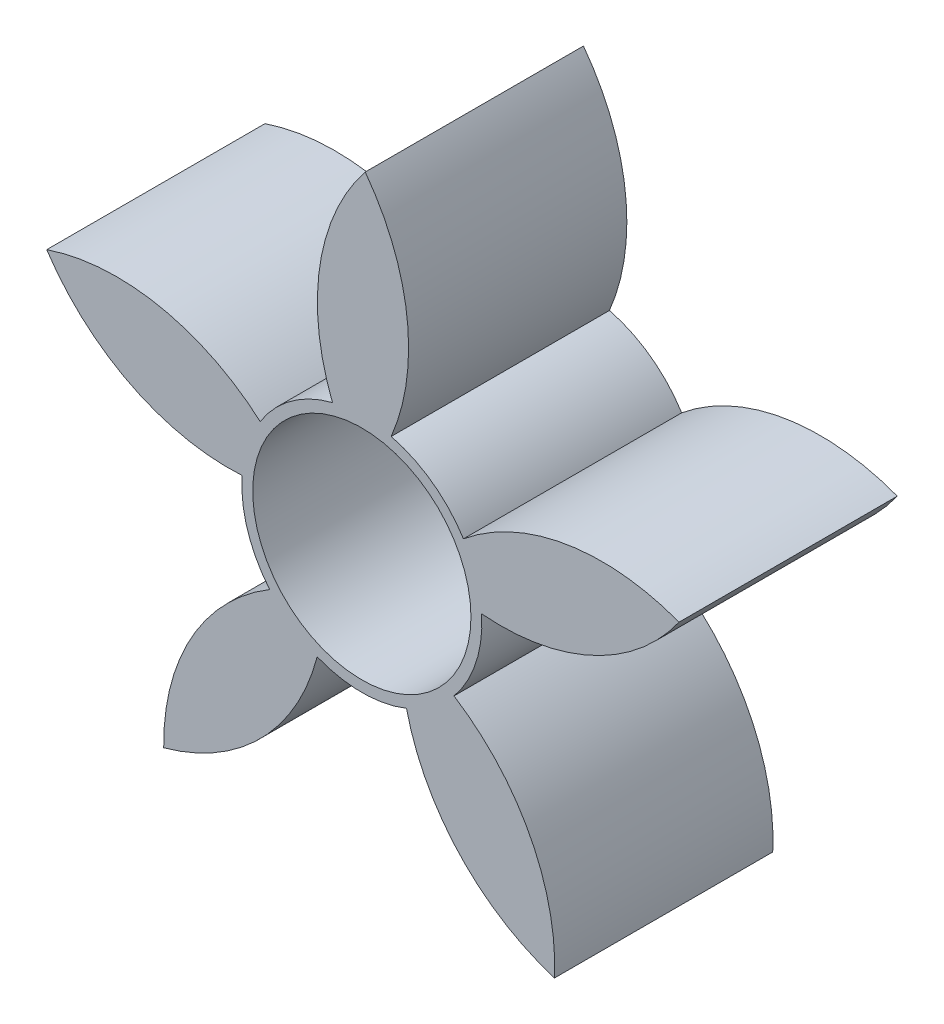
SolidWorks part; units mm, degrees
ref_plane "Front Plane" through (0, 0, 0) normal (0, 0, 1) x (1, 0, 0)
ref_plane "Top Plane" through (0, 0, 0) normal (0, 1, 0) x (1, 0, 0)
ref_plane "Right Plane" through (0, 0, 0) normal (1, 0, 0) x (0, 0, -1)
sketch "Sketch1" plane through (0, 0, 0) normal (0, 0, 1) x (1, 0, 0)
  line L0 (37.1628, 13.5459) -> (-20.3686, 13.5459) construction
  circle A0 centre (0, 0) radius 12.7
  arc A1 (11.8272, 7.435) -> (3.4163, 13.5459) centre (0, 0) ccw
  arc A2 (3.4163, 13.5459) -> (0.3935, 38.691) centre (-19.956, 23.4905) ccw
  arc A3 (0.3935, 38.691) -> (-3.4163, 13.5459) centre (20.2283, 22.8247) ccw
  arc A4 (36.919, 11.582) -> (11.8272, 7.435) centre (27.9584, -12.185) ccw
  arc A5 (13.9386, 0.9368) -> (36.919, 11.582) centre (16.174, 26.2383) ccw
  arc A6 (22.4237, -31.533) -> (10.7259, -8.9508) centre (-2.949, -30.3554) ccw
  arc A7 (5.1982, -12.9668) -> (22.4237, -31.533) centre (29.9521, -7.2743) ccw
  arc A8 (-23.0604, -31.0704) -> (-5.1982, -12.9668) centre (-29.781, -6.5757) ccw
  arc A9 (-10.7259, -8.9508) -> (-23.0604, -31.0704) centre (2.3374, -30.7341) ccw
  arc A10 (-36.6758, 12.3304) -> (-13.9386, 0.9368) centre (-15.4567, 26.2914) ccw
  arc A11 (-11.8272, 7.435) -> (-36.6758, 12.3304) centre (-28.5075, -11.7204) ccw
  arc A12 (-13.9386, 0.9368) -> (-10.7259, -8.9508) centre (0, 0) ccw
  arc A13 (-5.1982, -12.9668) -> (5.1982, -12.9668) centre (0, 0) ccw
  arc A14 (10.7259, -8.9508) -> (13.9386, 0.9368) centre (0, 0) ccw
  arc A15 (-3.4163, 13.5459) -> (-11.8272, 7.435) centre (0, 0) ccw
  point P34 (0, 0)
  dimension "D1" = 25.4
  dimension "D2" = 27.94
  dimension "D3" = 25.4
  dimension "D4" = 25.4
  dimension "D5" = 5
extrude "Boss-Extrude1" add sketch "Sketch1" along normal blind 25.4
